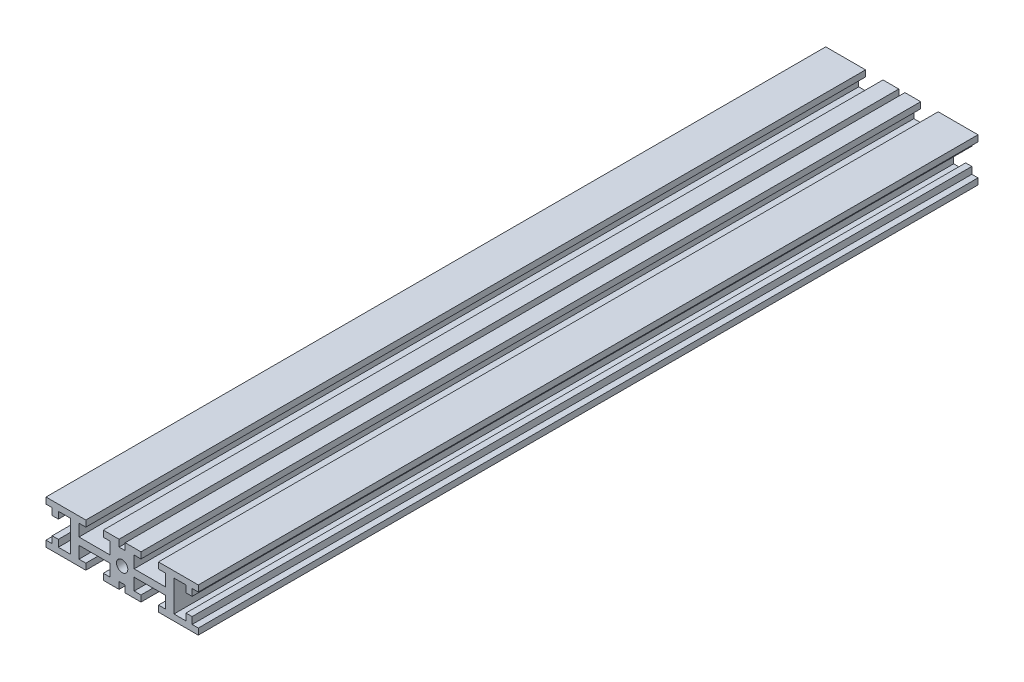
SolidWorks part; units mm, degrees
ref_plane "Front Plane" through (0, 0, 0) normal (0, 0, 1) x (1, 0, 0)
ref_plane "Top Plane" through (0, 0, 0) normal (0, 1, 0) x (1, 0, 0)
ref_plane "Right Plane" through (0, 0, 0) normal (1, 0, 0) x (0, 0, -1)
sketch "Sketch1" plane through (0, 0, 0) normal (0, 0, 1) x (1, 0, 0)
  line L0 (5.5, 6.35) -> (-5.5, 6.35)
  line L1 (-10.6, 6.35) -> (-22.225, 6.35)
  line L2 (-5.5, -6.35) -> (5.5, -6.35)
  line L3 (-3.5, 1.05) -> (-12.6, 1.05)
  line L4 (-20.425, 2.55) -> (-20.425, 4.55)
  line L5 (-3.5, -1.05) -> (-12.6, -1.05)
  line L6 (0, -6.35) -> (0, 6.35) construction
  line L7 (3.5, 4.55) -> (3.5, 1.05)
  line L8 (12.6, 1.05) -> (12.6, 4.55)
  line L9 (5.5, -4.55) -> (3.5, -4.55)
  line L10 (22.225, -6.35) -> (10.6, -6.35)
  line L11 (-12.6, 4.55) -> (-10.6, 4.55)
  line L12 (12.6, -1.05) -> (12.6, -4.55)
  line L13 (-10.6, 4.55) -> (-10.6, 6.35)
  line L14 (5.5, -4.55) -> (5.5, -6.35)
  line L15 (-15.125, 4.55) -> (-18.625, 4.55)
  line L16 (10.6, -4.55) -> (10.6, -6.35)
  line L17 (3.5, -4.55) -> (3.5, -1.05)
  line L18 (12.6, -4.55) -> (10.6, -4.55)
  line L19 (20.425, -2.55) -> (20.425, -4.55)
  line L20 (18.625, 2.55) -> (20.425, 2.55)
  line L21 (-3.5, 4.55) -> (-5.5, 4.55)
  line L22 (18.625, -2.55) -> (20.425, -2.55)
  line L23 (-5.5, 4.55) -> (-5.5, 6.35)
  line L24 (15.125, 4.55) -> (15.125, -4.55)
  line L25 (18.625, -4.55) -> (15.125, -4.55)
  line L26 (18.625, -4.55) -> (18.625, -2.55)
  line L27 (18.625, 4.55) -> (18.625, 2.55)
  line L28 (5.5, 4.55) -> (5.5, 6.35)
  line L29 (3.5, 4.55) -> (5.5, 4.55)
  line L30 (15.125, 4.55) -> (18.625, 4.55)
  line L31 (-18.625, 4.55) -> (-18.625, 2.55)
  line L32 (-18.625, -4.55) -> (-18.625, -2.55)
  line L33 (-18.625, -4.55) -> (-15.125, -4.55)
  line L34 (-15.125, 4.55) -> (-15.125, -4.55)
  line L35 (-18.625, -2.55) -> (-20.425, -2.55)
  line L36 (-18.625, 2.55) -> (-20.425, 2.55)
  line L37 (10.6, 4.55) -> (10.6, 6.35)
  line L38 (-20.425, 4.55) -> (-22.225, 4.55)
  line L39 (12.6, 4.55) -> (10.6, 4.55)
  line L40 (3.5, -1.05) -> (12.6, -1.05)
  line L41 (-12.6, -4.55) -> (-10.6, -4.55)
  line L42 (20.425, -4.55) -> (22.225, -4.55)
  line L43 (3.5, 1.05) -> (12.6, 1.05)
  line L44 (10.6, 6.35) -> (22.225, 6.35)
  line L45 (-22.225, -6.35) -> (-22.225, -4.55)
  line L46 (-3.5, -4.55) -> (-3.5, -1.05)
  line L47 (-22.225, 6.35) -> (-22.225, 4.55)
  line L48 (-10.6, -4.55) -> (-10.6, -6.35)
  line L49 (-20.425, -2.55) -> (-20.425, -4.55)
  line L50 (-5.5, -4.55) -> (-5.5, -6.35)
  line L51 (-20.425, -4.55) -> (-22.225, -4.55)
  line L52 (22.225, -4.55) -> (22.225, -6.35)
  line L53 (20.425, 2.55) -> (20.425, 4.55)
  line L54 (20.425, 4.55) -> (22.225, 4.55)
  line L55 (-12.6, -1.05) -> (-12.6, -4.55)
  line L56 (22.225, 4.55) -> (22.225, 6.35)
  line L57 (-22.225, -6.35) -> (-10.6, -6.35)
  line L59 (-5.5, -4.55) -> (-3.5, -4.55)
  line L63 (-12.6, 1.05) -> (-12.6, 4.55)
  line L65 (-3.5, 4.55) -> (-3.5, 1.05)
  point P14 (-5.5, -5.45)
  point P15 (-10.6, -5.45)
  dimension "D11" = 6.35
  dimension "D16" = 2
  dimension "D6" = 12.7
  dimension "D8" = 5.5
  dimension "D5" = 1.8
  dimension "D7" = 5.1
  dimension "D9" = 5.5
  dimension "D10" = 3.5
  dimension "D12" = 2
  dimension "D13" = 1.8
  dimension "D14" = 44.45
  dimension "D15" = 1.8
  dimension "D17" = 3.5
  dimension "D18" = 1.8
  dimension "D19" = 2
  dimension "D20" = 1.8
  dimension "D22" = 2
  dimension "D23" = 1.8
  dimension "D26" = 2
  dimension "D27" = 2
  dimension "D29" = 3.5
  dimension "D33" = 9.1
  dimension "D41" = 1.8
extrude "Boss-Extrude1" add sketch "Sketch1" along normal blind 227.6
sketch "Sketch2" plane through (0, 0, 227.6) normal (0, 0, 1) x (1, 0, 0)
  circle A1 centre (0, 0) radius 2
  dimension "D3" = 4
hole_wizard "M4 Tapped Hole1" positions "3DSketch1" profile "Sketch3" tap size "M4" standard "DIN"
sketch3d "3DSketch1"
  point P0 (0, 0, 227.6)
sketch "Sketch3" plane through (0, 0, 227.6) normal (1, 0, 0) x (0, -1, 0)
  line L0 (0, 0) -> (0, 227.6)
  line L1 (0, 227.6) -> (1.65, 227.6)
  line L2 (1.65, 227.6) -> (1.65, 0)
  line L5 (1.65, 0) -> (0, 0)
  line L11 (0, -6.35) -> (0, 107.95) construction
  dimension "Thru Tap Drill Dia." = 3.3
  dimension "Thru Tap Drill Depth" = 227.6
sketch "Sketch5" plane through (0, 0, 227.6) normal (0, 0, 1) x (1, 0, 0)
  line L2 (-0.9, -6.35) -> (0.9, -6.35)
  line L3 (-0.9, -6.35) -> (-0.9, -4.35)
  line L4 (-0.9, -4.35) -> (0.9, -4.35)
  line L5 (0.9, -6.35) -> (0.9, -4.35)
  line L6 (0.9, 6.35) -> (-0.9, 6.35)
  line L7 (0.9, 6.35) -> (0.9, 4.35)
  line L8 (0.9, 4.35) -> (-0.9, 4.35)
  line L9 (-0.9, 6.35) -> (-0.9, 4.35)
  line L11 (-5.5, -6.35) -> (5.5, -6.35) construction
  line L22 (5.5, 6.35) -> (-5.5, 6.35) construction
  point P4 (0, 4.35)
  dimension "D1" = 1.8
  dimension "D2" = 2
  dimension "D3" = 2
  dimension "D6" = 1.8
extrude "Cut-Extrude1" cut sketch "Sketch5" against normal through all
